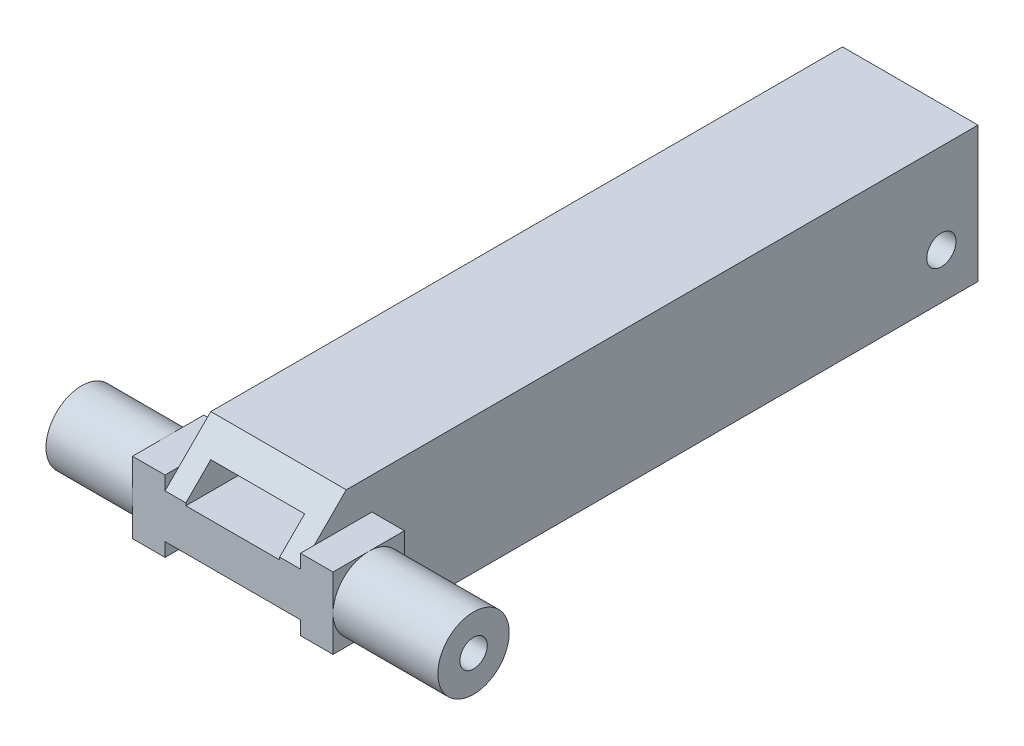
SolidWorks part; units mm, degrees
ref_plane "Спереди" through (0, 0, 0) normal (0, 0, 1) x (1, 0, 0)
ref_plane "Сверху" through (0, 0, 0) normal (0, 1, 0) x (1, 0, 0)
ref_plane "Справа" through (0, 0, 0) normal (1, 0, 0) x (0, 0, -1)
sketch "Эскиз1" plane through (0, 0, 0) normal (1, 0, 0) x (0, 0, -1)
  line L1 (37, -7.4) -> (-37, -7.4)
  line L2 (37, -7.4) -> (37, 7.4)
  line L3 (37, 7.4) -> (-37, 7.4)
  line L4 (-37, -7.4) -> (-37, 7.4)
  line L5 (37, -7.4) -> (-37, 7.4) construction
  line L6 (37, 7.4) -> (-37, -7.4) construction
  point P0 (0, 0)
  dimension "D1" = 14.8
  dimension "D2" = 74
extrude "Бобышка-Вытянуть1" add sketch "Эскиз1" along normal blind 14.8
sketch "Эскиз2" plane through (0, 0, -37) normal (0, 0, -1) x (-1, 0, 0)
  line L0 (0, 7.4) -> (-14.8, -7.4) construction
  line L2 (-2.275, -5.125) -> (-12.525, -5.125)
  line L3 (-2.275, -5.125) -> (-2.275, 5.125)
  line L4 (-2.275, 5.125) -> (-12.525, 5.125)
  line L5 (-12.525, -5.125) -> (-12.525, 5.125)
  line L6 (-2.275, -5.125) -> (-12.525, 5.125) construction
  line L7 (-2.275, 5.125) -> (-12.525, -5.125) construction
  point P4 (-7.4, 0)
  dimension "D1" = 10.25
extrude "Вырез-Вытянуть1" cut sketch "Эскиз2" against normal blind 65
sketch "Эскиз3" plane through (14.8, 0, 0) normal (1, 0, 0) x (0, 0, -1)
  line L0 (37, 0) -> (-37, 0) construction
  line L1 (37, -7.4) -> (37, 7.4) construction
  line L2 (-37, 7.4) -> (-37, -7.4) construction
  circle A0 centre (-33.1, 0) radius 3.9
  dimension "D1" = 7.8
extrude "Бобышка-Вытянуть2" add sketch "Эскиз3" along normal blind 15
sketch "Эскиз4" plane through (0, 0, 0) normal (-1, 0, 0) x (0, 0, 1)
  line L0 (37, 0) -> (-37, 0) construction
  line L1 (37, 7.4) -> (37, -7.4) construction
  line L2 (-37, -7.4) -> (-37, 7.4) construction
  circle A0 centre (33.1, 0) radius 3.9
  dimension "D1" = 7.8
extrude "Бобышка-Вытянуть3" add sketch "Эскиз4" along normal blind 13
chamfer "Фаска1" distance 5 angle 45 2 edges at (7.4, -7.4, 37) (7.4, 7.4, 37)
sketch "Эскиз8" plane through (29.8, 0, 0) normal (1, 0, 0) x (0, 0, -1)
  circle A0 centre (-33.1, 0) radius 1.45
  dimension "D1" = 2.9
extrude "Вырез-Вытянуть4" cut sketch "Эскиз8" against normal through all
sketch "Эскиз9" plane through (0, 0, 0) normal (-1, 0, 0) x (0, 0, 1)
  line L1 (37, -3.9) -> (29.2, -3.9)
  line L2 (37, -3.9) -> (37, 3.9)
  line L3 (37, 3.9) -> (29.2, 3.9)
  line L4 (29.2, -3.9) -> (29.2, 3.9)
  line L5 (37, -3.9) -> (29.2, 3.9) construction
  line L6 (37, 3.9) -> (29.2, -3.9) construction
  circle A0 centre (33.1, 0) radius 3.9 construction
  circle A1 centre (33.1, 0) radius 1.5
  point P0 (33.1, 0)
  point P6 (29.2, 0)
  point P11 (33.1, 3.9)
  dimension "D1" = 3
extrude "Бобышка-Вытянуть4" add sketch "Эскиз9" along normal blind 3.55
sketch "Эскиз10" plane through (14.8, 0, 0) normal (1, 0, 0) x (0, 0, -1)
  line L1 (-37, -3.9) -> (-29.2, -3.9)
  line L2 (-37, -3.9) -> (-37, 3.9)
  line L3 (-37, 3.9) -> (-29.2, 3.9)
  line L4 (-29.2, -3.9) -> (-29.2, 3.9)
  line L5 (-37, -3.9) -> (-29.2, 3.9) construction
  line L6 (-37, 3.9) -> (-29.2, -3.9) construction
  circle A0 centre (-33.1, 0) radius 3.9 construction
  point P0 (-33.1, 0)
  point P6 (-29.2, 0)
  point P9 (-33.1, 3.9)
extrude "Бобышка-Вытянуть5" add sketch "Эскиз10" along normal blind 3.55
sketch "Sketch1" plane through (0, 0, 0) normal (-1, 0, 0) x (0, 0, 1)
  line L0 (-33, 7.4) -> (-33, -7.4) construction
  line L7 (-37, 7.4) -> (32, 7.4) construction
  line L8 (32, -7.4) -> (-37, -7.4) construction
  line L9 (-37, -7.4) -> (-37, 7.4) construction
  circle A0 centre (-33, -2.4) radius 1.6
  point P8 (0, 0)
  dimension "D1" = 3.2
  dimension "D2" = 4
  dimension "D3" = 5
extrude "Cut-Extrude1" cut sketch "Sketch1" against normal through all
sketch "Sketch2" plane through (29.8, 0, 0) normal (1, 0, 0) x (0, 0, -1)
  circle A0 centre (-33.1, 0) radius 1.5
extrude "Cut-Extrude2" cut sketch "Sketch2" against normal through all
sketch "Sketch3" plane through (0, 0, 28) normal (0, 0, -1) x (-1, 0, 0)
  line L0 (-7.4, 5.125) -> (-7.4, -5.125) construction
  line L1 (-2.275, 5.125) -> (-12.525, 5.125) construction
  line L2 (-12.525, -5.125) -> (-2.275, -5.125) construction
  line L4 (-2.275, 2.125) -> (-12.525, 2.125)
  line L5 (-2.275, 2.125) -> (-2.275, 5.125)
  line L6 (-2.275, 5.125) -> (-12.525, 5.125)
  line L7 (-12.525, 2.125) -> (-12.525, 5.125)
  line L8 (-2.275, 2.125) -> (-12.525, 5.125) construction
  line L9 (-2.275, 5.125) -> (-12.525, 2.125) construction
  point P6 (-7.4, 3.625)
  dimension "D1" = 3
extrude "Cut-Extrude3" cut sketch "Sketch3" against normal through all
